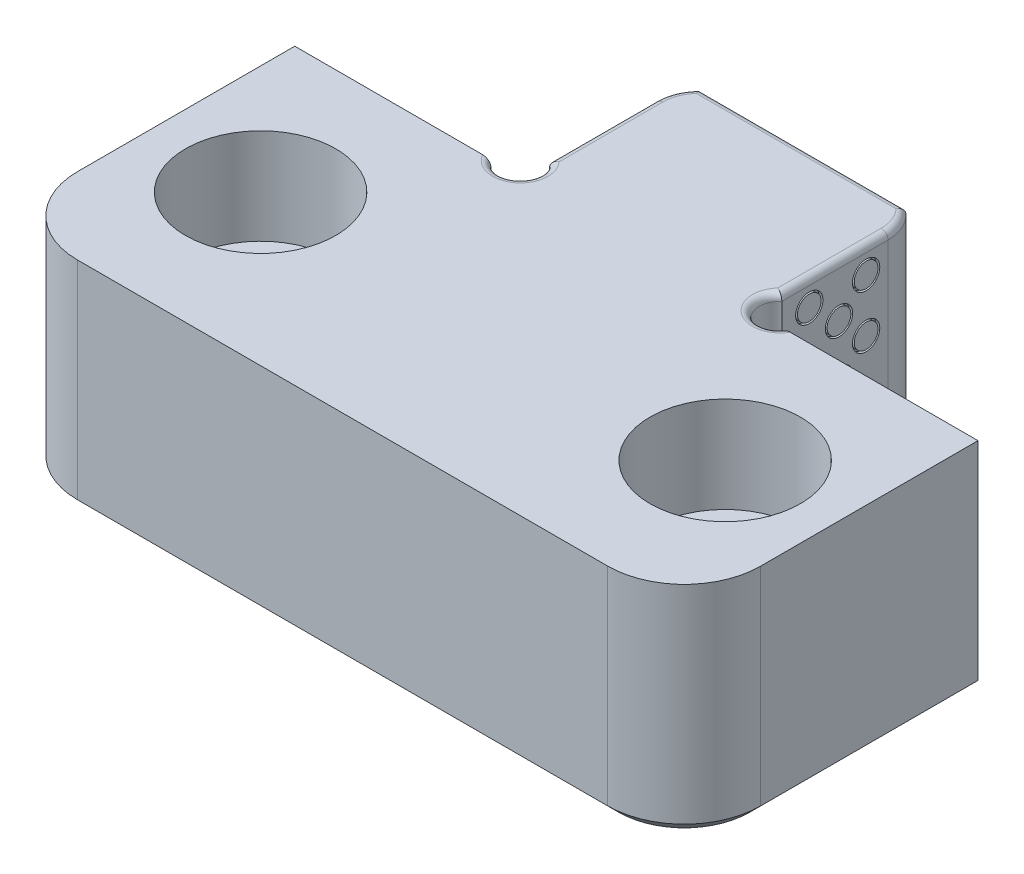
SolidWorks part; units mm, degrees
ref_plane "Front Plane" through (0, 0, 0) normal (0, 0, 1) x (1, 0, 0)
ref_plane "Top Plane" through (0, 0, 0) normal (0, 1, 0) x (1, 0, 0)
ref_plane "Right Plane" through (0, 0, 0) normal (1, 0, 0) x (0, 0, -1)
sketch "Sketch1" plane through (0, 0, 0) normal (0, 1, 0) x (1, 0, 0)
  line L0 (-25, -21.5) -> (25, -21.5)
  line L6 (-8.4965, 0) -> (-8.4965, 12.2)
  line L7 (-8.4965, 12.2) -> (8.4965, 12.2)
  line L8 (8.4965, 12.2) -> (8.4965, 0)
  line L9 (8.4965, 0) -> (25, 0)
  line L10 (25, 0) -> (25, -21.5)
  line L12 (0, 0) -> (0, 50000) construction
  line L13 (0, 0) -> (-50000, 0) construction
  line L21 (-25, 0) -> (-25, -21.5)
  line L22 (-8.4965, 0) -> (-25, 0)
  dimension "D1" = 16.993
  dimension "D2" = 21.5
  dimension "D3" = 33.7
  dimension "D4" = 50
extrude "Boss-Extrude1" add sketch "Sketch1" against normal blind 16 separate body
sketch "Sketch2" plane through (0, 0, 0) normal (0, 1, 0) x (1, 0, 0)
  line L0 (0, 0) -> (50000, 0) construction
  line L1 (0, 0) -> (0, 50000) construction
  line L4 (-8.4965, 12.2) -> (-8.4965, 0) construction
  line L5 (8.4965, 12.2) -> (-8.4965, 12.2) construction
  line L12 (8.4965, 5.85) -> (8.4965, 9.92)
  line L13 (8.4965, 5.85) -> (12.7, 5.85)
  line L14 (12.7, 5.85) -> (12.7, 18.55)
  line L15 (-12.7, 18.55) -> (12.7, 18.55)
  line L16 (-12.7, 5.85) -> (-12.7, 18.55)
  line L17 (-8.4965, 5.85) -> (-12.7, 5.85)
  line L18 (-8.4965, 5.85) -> (-8.4965, 9.92)
  line L19 (-7.5259, 12.2) -> (7.5259, 12.2)
  arc A0 (8.4965, 9.92) -> (8.2572, 11.6467) centre (2.1465, 9.92) ccw construction
  arc A1 (8.2572, 11.6467) -> (7.5259, 12.2) centre (7.5259, 11.44) ccw construction
  arc A2 (8.4965, 9.92) -> (7.5259, 12.2) centre (5.3333, 9.92) ccw
  arc A6 (-8.2572, 11.6467) -> (-7.5259, 12.2) centre (-7.5259, 11.44) cw construction
  arc A7 (-8.4965, 9.92) -> (-8.2572, 11.6467) centre (-2.1465, 9.92) cw construction
  arc A8 (-8.4965, 9.92) -> (-7.5259, 12.2) centre (-5.3333, 9.92) cw
  dimension "D1" = 6.35
  dimension "D3" = 25.4
  dimension "D4" = 0.76
  dimension "D5" = 6.35
  dimension "D6" = 2.28
  dimension "D2" = 12.7
extrude "Cut-Extrude1" cut sketch "Sketch2" against normal through all
sketch "Sketch3" plane through (0, 0, 0) normal (0, 1, 0) x (1, 0, 0)
  line L0 (0, 0) -> (0, 50000) construction
  line L1 (0, 0) -> (50000, 0) construction
  line L6 (25, -0.51) -> (8.4965, -0.51)
  line L7 (25, -0.51) -> (8.4965, -0.51) construction
  line L9 (7.9865, 0) -> (7.9865, 9.92)
  line L10 (7.9865, 0) -> (7.9865, 9.92) construction
  circle A0 centre (9.5065, 1.01) radius 1.52
  circle A1 centre (-9.5065, 1.01) radius 1.52
  dimension "D1" = 1.52
  dimension "D2" = 0.51
  dimension "D3" = 0.51
extrude "Cut-Extrude2" cut sketch "Sketch3" against normal through all
sketch "Sketch5" plane through (25, 0, 0) normal (1, 0, 0) x (0, 0, -1)
  line L0 (-63.088, -15.746) -> (49936.912, -15.746) construction
  line L1 (-21.5, -16) -> (0, -16) construction
  line L2 (12.2, -16) -> (12.2, 0) construction
  line L3 (0, 9.7237) -> (0, -49990.2763) construction
  line L4 (0, -16) -> (0, 0) construction
  line L5 (-10.75, 0) -> (-10.75, 50000) construction
  line L6 (-21.5, 0) -> (0, 0) construction
  line L7 (0, -15.746) -> (0, -45.2857)
  line L8 (0, -15.746) -> (2.1, -15.746)
  line L9 (50, 4.7143) -> (50, -45.2857)
  line L10 (50, -45.2857) -> (0, -45.2857)
  arc A0 (2.1, -15.746) -> (50, 4.7143) centre (2.1, 50.554) ccw
  point P16 (-10.75, 0)
  dimension "D2" = 66.3
  dimension "D3" = 10.1
  dimension "D1" = 0.254
  dimension "D4" = 50
  dimension "D5" = 50
extrude "Cut-Extrude3" cut sketch "Sketch5" against normal through all
fillet "Fillet1" radius 5.6 2 edges at (-25, -8, 21.5) (25, -8, 21.5)
fillet "Fillet2" radius 0.5 20 edges at (-8.1601, -15.099, -11.3395) (8.3155, -15.1494, -10.9746) (8.4965, 0, -6.033) (-8.2437, 0, -11.159) (0, -14.9722, -12.2) (-8.4965, -15.6288, -6.0398) (8.4965, -15.6288, -6.0398) (8.2437, 0, -11.159) (0, 0, -12.2) (-8.4965, 0, -6.033) (9.5065, -16, 0.51) (8.3706, -15.873, 0) (-8.3706, -15.873, 0) (-9.5065, -16, 0.51) (-8.4317, 0, 0.0648) (8.4317, 0, 0.0648) (7.9875, -15.746, -1.0654) (-7.9875, -15.746, -1.0654)
chamfer "Chamfer1" distance 0.8 angle 45 5 edges at (-25, -16, 7.95) (-23.3598, -16, 19.8598) (0, -16, 21.5) (23.3598, -16, 19.8598) (25, -16, 7.95)
hole_wizard "CBORE for M6 SHCS1" positions "Sketch10" profile "Sketch9" counterbore size "M6" standard "Ansi Metric"
sketch "Sketch10" plane through (0, 0, 0) normal (0, 1, 0) x (-1, 0, 0)
  line L0 (0, 0) -> (0, 50000) construction
  line L1 (19.4, 21.5) -> (-19.4, 21.5) construction
  line L2 (-25, 15.9) -> (-25, 0) construction
  point P0 (-17, 10.5)
  point P6 (0, 21.5)
  point P9 (17, 10.5)
  dimension "D1" = 8
  dimension "D2" = 11
sketch "Sketch9" plane through (17, 0, 10.5) normal (1, 0, 0) x (0, 0, 1)
  line L0 (0, 0) -> (0, 16.0485)
  line L1 (0, 16.0485) -> (3.3, 16.0485)
  line L3 (3.3, 16.0485) -> (3.3, 7)
  line L4 (3.3, 7) -> (5.5, 7)
  line L5 (5.5, 7) -> (5.5, 0)
  line L7 (5.5, 0) -> (0, 0)
  line L11 (0, -6.35) -> (0, 107.95) construction
  dimension "Thru Hole Dia." = 6.6
  dimension "Thru Hole Depth" = 16.0485
  dimension "C'Bore Dia." = 11
  dimension "C'Bore Depth" = 7
sketch "Sketch8" plane through (8.4965, 0, 0) normal (1, 0, 0) x (0, 0, -1)
  circle A0 centre (8.3158, -1.9076) radius 1
  circle A1 centre (8.3158, -1.9076) radius 0.87
  circle A2 centre (8.3158, -13.4461) radius 1
  circle A3 centre (8.3158, -13.4461) radius 0.87
  circle A4 centre (8.3158, -9.7967) radius 1
  circle A5 centre (8.3158, -9.7967) radius 0.87
  circle A6 centre (8.3158, -5.7717) radius 1
  circle A7 centre (8.3158, -5.7717) radius 0.87
  circle A8 centre (6.3301, -3.8397) radius 1
  circle A9 centre (6.3301, -3.8397) radius 0.87
  circle A12 centre (6.3301, -11.7287) radius 1
  circle A13 centre (6.3301, -11.7287) radius 0.87
  circle A14 centre (6.3301, -7.7037) radius 1
  circle A15 centre (6.3301, -7.7037) radius 0.87
  circle A16 centre (4.1566, -1.9076) radius 1
  circle A17 centre (4.1566, -1.9076) radius 0.87
  circle A18 centre (4.1566, -13.4461) radius 1
  circle A19 centre (4.1566, -13.4461) radius 0.87
  circle A20 centre (4.1566, -9.7967) radius 1
  circle A21 centre (4.1566, -9.7967) radius 0.87
  circle A22 centre (4.1566, -5.7717) radius 1
  circle A23 centre (4.1566, -5.7717) radius 0.87
extrude "Cut-Extrude4" cut sketch "Sketch8" against normal blind 0.254
mirror "Mirror1" about plane through (0, 0, 0) normal (1, 0, 0) of "Cut-Extrude4"
